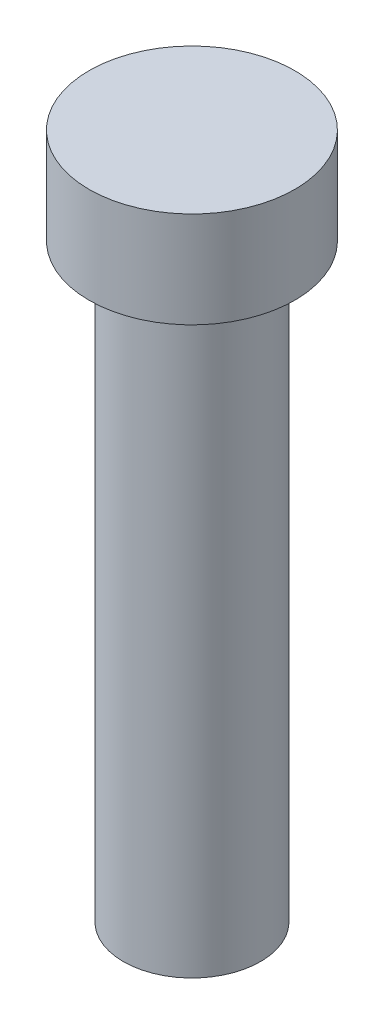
SolidWorks part; units mm, degrees
ref_plane "Front Plane" through (0, 0, 0) normal (0, 0, 1) x (1, 0, 0)
ref_plane "Top Plane" through (0, 0, 0) normal (0, 1, 0) x (1, 0, 0)
ref_plane "Right Plane" through (0, 0, 0) normal (1, 0, 0) x (0, 0, -1)
sketch "Sketch1" plane through (0, 0, 0) normal (0, 0, 1) x (1, 0, 0)
  line L0 (0, 0) -> (0, 50)
  line L1 (0, 50) -> (7.5, 50)
  line L2 (7.5, 50) -> (7.5, 43)
  line L3 (7.5, 43) -> (5, 43)
  line L4 (5, 43) -> (5, 0)
  line L5 (5, 0) -> (0, 0)
  line L6 (0, 0) -> (0, -47.6414) construction
  point P10 (7.5, 50)
  dimension "D1" = 10
  dimension "D2" = 15
  dimension "D3" = 7
  dimension "D4" = 50
revolve "Revolve1" add sketch "Sketch1" angle 360 about L6
